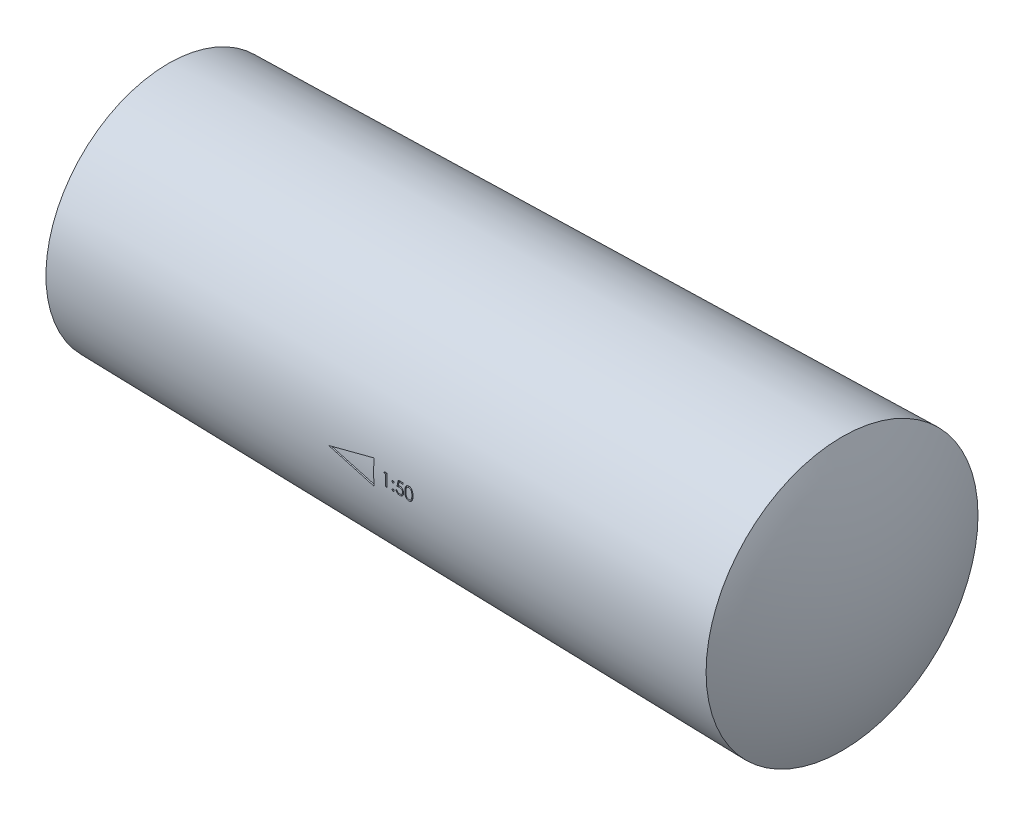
SolidWorks part; units mm, degrees
ref_plane "Front Plane" through (0, 0, 0) normal (0, 0, 1) x (1, 0, 0)
ref_plane "Top Plane" through (0, 0, 0) normal (0, 1, 0) x (1, 0, 0)
ref_plane "Right Plane" through (0, 0, 0) normal (1, 0, 0) x (0, 0, -1)
sketch "Sketch1" plane through (0, 0, 0) normal (1, 0, 0) x (0, 0, -1)
  circle A0 centre (0, 0) radius 10
  dimension "D1" = 20
extrude "Extrude1" add sketch "Sketch1" along normal mid plane 55
draft "Draft1" type of draft neutral plane draft angle 1.146 faces to draft 1 parameters "D1"=1.146
sketch "Sketch2" plane through (0, 0, 0) normal (0, 0, 1) x (1, 0, 0)
  line L0 (-27.5, 0) -> (-27.5, 10)
  line L1 (-27.5, 10) -> (-27.5, -10) construction
  line L2 (-27.5, 0) -> (-30, 0)
  line L3 (-30, 0) -> (-30, -10.55) construction
  line L4 (27.5, 0) -> (27.5, 11.1)
  line L5 (27.5, -11.1) -> (27.5, 11.1) construction
  line L6 (27.5, 0) -> (30, 0)
  line L7 (30, 0) -> (30, -10.55) construction
  line L8 (-27.5, -10) -> (27.5, -11.1) construction
  arc A0 (-30, 0) -> (-27.5, 10) centre (-8.75, 0) cw
  arc A1 (30, 0) -> (27.5, 11.1) centre (4.1078, 0) ccw
  point P14 (0, -10.55)
revolve "Revolve1" add sketch "Sketch2" angle 360 about L2
sketch "Sketch5" plane through (0, 0, 0) normal (0, 0, 1) x (1, 0, 0)
  line L0 (0, 10.55) -> (0, -10.55) construction
  line L1 (27.5, 11.1) -> (-27.5, 10) construction
  line L2 (-27.5, -10) -> (27.5, -11.1) construction
ref_plane "Plane2" through (0, 0, 0) normal (-0.02, 0, 0.9998) x (0.9998, 0, 0.02)
sketch "Sketch6" plane through (0, 0, 0) normal (-0.02, 0, 0.9998) x (0.9998, 0, 0.02)
  line L0 (0, 0) -> (0, 1)
  line L1 (0, 10.55) -> (0, -10.55) construction
  line L2 (0, 1) -> (-3.7321, 0)
  line L3 (-3.7321, 0) -> (0, -1)
  line L4 (0, -1) -> (0, 0)
  line L5 (0, -0.5) -> (4, -0.5) construction
  text T0 "1:50" font "Century Gothic" height 1
  dimension "D1" = 2
  dimension "D2" = 30
  dimension "D3" = 4
wrap "Wrap2" sketch "Sketch6" wrap type deboss source sketch "Sketch6" thickness 0.1 parameters "D1"=0.1
equation "\"D2@Sketch2\" = \"D1@Sketch2\""
